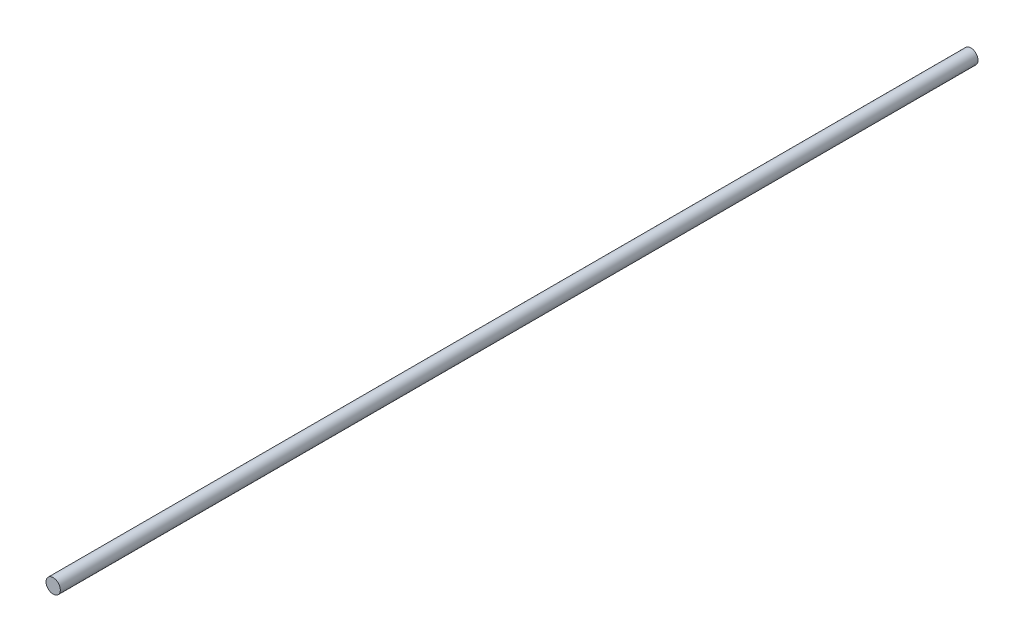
SolidWorks part; units mm, degrees
ref_plane "Front Plane" through (0, 0, 0) normal (0, 0, 1) x (1, 0, 0)
ref_plane "Top Plane" through (0, 0, 0) normal (0, 1, 0) x (1, 0, 0)
ref_plane "Right Plane" through (0, 0, 0) normal (1, 0, 0) x (0, 0, -1)
sketch "Sketch1" plane through (0, 0, 0) normal (0, 0, 1) x (1, 0, 0)
  circle A0 centre (0, 0) radius 4.7625
extrude "Extrude1" add sketch "Sketch1" along normal blind 609.6
